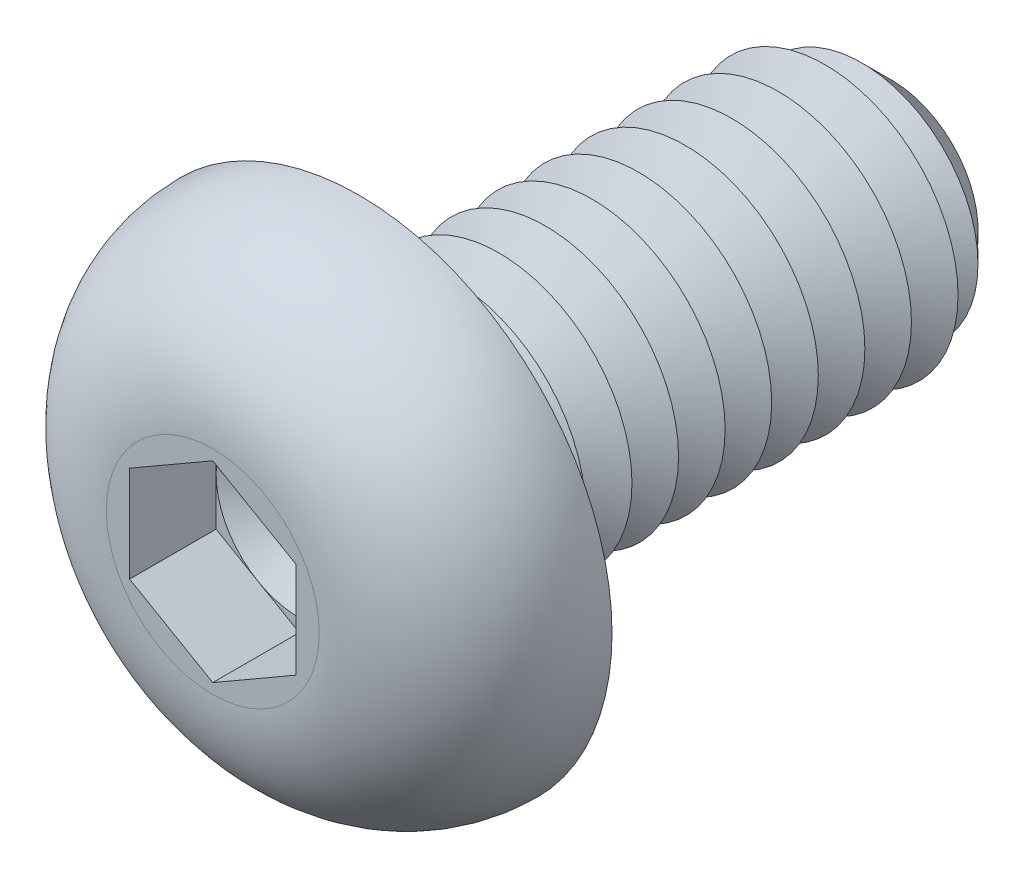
SolidWorks part; units mm, degrees
ref_plane "Front Plane" through (0, 0, 0) normal (0, 0, 1) x (1, 0, 0)
ref_plane "Top Plane" through (0, 0, 0) normal (0, 1, 0) x (1, 0, 0)
ref_plane "Right Plane" through (0, 0, 0) normal (1, 0, 0) x (0, 0, -1)
sketch "Sketch1" plane through (0, 0, 0) normal (1, 0, 0) x (0, 0, -1)
  line L0 (-47.9342, 0) -> (60.3146, 0) construction
sketch "Sketch2" plane through (0, 0, 0) normal (1, 0, 0) x (0, 0, -1)
  line L0 (0, 0) -> (-2.2, 0)
  line L1 (-47.9342, 0) -> (60.3146, 0) construction
  line L2 (-2.2, 0) -> (-2.2, 1.6)
  line L3 (0, 3.8) -> (0, 0)
  arc A0 (-2.2, 1.6) -> (0, 3.8) centre (0, 1.6) cw
  dimension "D1" = 2.2
  dimension "D2" = 2.2
  dimension "D3" = 3.8
revolve "Revolve1" add sketch "Sketch2" angle 360 about L0
sketch "Sketch3" plane through (0, 0, 2.2) normal (0, 0, 1) x (1, 0, 0)
  line L1 (0, 1.4434) -> (-1.25, 0.7217)
  line L2 (-1.25, 0.7217) -> (-1.25, -0.7217)
  line L3 (-1.25, -0.7217) -> (0, -1.4434)
  line L4 (0, -1.4434) -> (1.25, -0.7217)
  line L5 (1.25, -0.7217) -> (1.25, 0.7217)
  line L6 (1.25, 0.7217) -> (0, 1.4434)
  circle A0 centre (0, 0) radius 1.25 construction
  dimension "D1" = 2.5
extrude "Cut-Extrude1" cut sketch "Sketch3" against normal blind 1.3
sketch "Sketch4" plane through (0, 0, 0) normal (0, 0, -1) x (-1, 0, 0)
  circle A0 centre (0, 0) radius 2
  dimension "D1" = 4
extrude "Boss-Extrude1" add sketch "Sketch4" along normal blind 8
chamfer "Chamfer1" distance 0.7 angle 45 1 edges at (-2, 0, -8)
sketch "Sketch5" plane through (0, 0, 0) normal (1, 0, 0) x (0, 0, -1)
  line L0 (0.7, 2) -> (1.4, 2)
  line L1 (7.3, 2) -> (0, 2) construction
  line L2 (1.4, 2) -> (1.05, 1.3938)
  line L3 (1.05, 1.3938) -> (0.7, 2)
  line L4 (0, -3.8) -> (0, 3.8) construction
  line L5 (7.3, 2) -> (0, 2) construction
  dimension "D1" = 0.7
  dimension "D2" = 0.7
revolve "Cut-Revolve1" cut sketch "Sketch5" angle 360 about L0
pattern_linear "LPattern1" count 10 spacing 0.7 along (0, 0, -1) of "Cut-Revolve1"
fillet "Fillet2" radius 0.3 1 edges at (2, 0, 0)
sketch "Sketch6" plane through (0, 0, 0.9) normal (0, 0, 1) x (1, 0, 0)
  line L0 (0, -1.4434) -> (1.25, -0.7217) construction
  circle A0 centre (0, 0) radius 1.25
extrude "Cut-Extrude2" cut sketch "Sketch6" against normal through all draft 60
